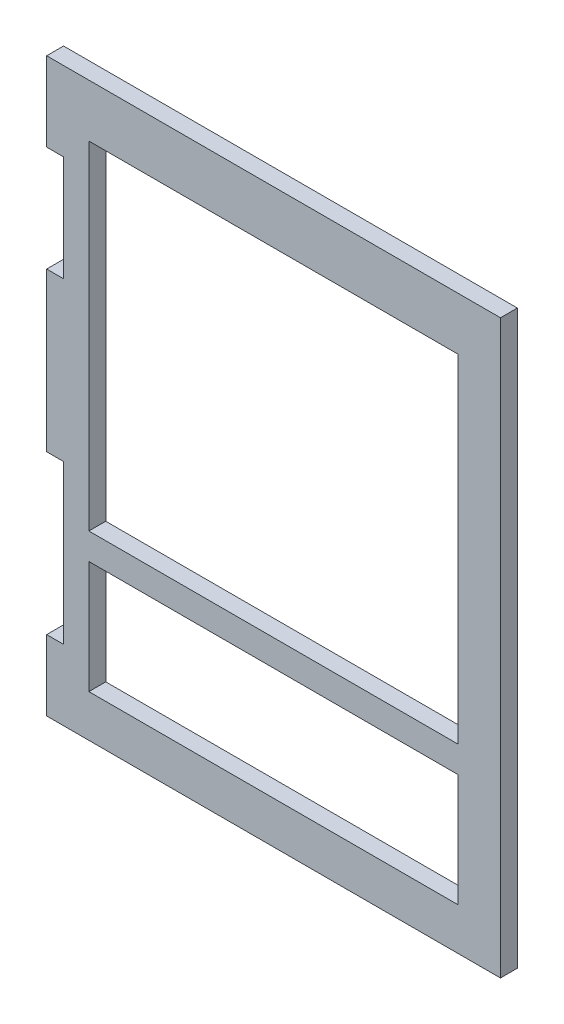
SolidWorks part; units mm, degrees
ref_plane "Front Plane" through (0, 0, 0) normal (0, 0, 1) x (1, 0, 0)
ref_plane "Top Plane" through (0, 0, 0) normal (0, 1, 0) x (1, 0, 0)
ref_plane "Right Plane" through (0, 0, 0) normal (1, 0, 0) x (0, 0, -1)
sketch "Sketch1" plane through (0, 0, 0) normal (0, 0, 1) x (1, 0, 0)
  line L0 (-110.683, 618) -> (-110.683, 543) construction
  line L1 (0, 579.0668) -> (25, 579.0668) construction
  line L2 (0, 76.2) -> (0, 618)
  line L3 (0, 618) -> (430, 618)
  line L4 (430, 76.2) -> (430, 618)
  line L5 (11.9364, 443) -> (11.9364, 293) construction
  line L6 (0, 543) -> (16, 543)
  line L7 (0, 543) -> (0, 443)
  line L8 (0, 443) -> (16, 443)
  line L9 (16, 543) -> (16, 443)
  line L10 (215, 618) -> (215, 76.2) construction
  line L11 (430, 76.2) -> (0, 76.2)
  line L12 (0, 293) -> (16, 293)
  line L13 (0, 293) -> (0, 143)
  line L14 (0, 143) -> (16, 143)
  line L15 (85.4112, 618) -> (85.4112, 568) construction
  line L16 (430, 568) -> (390, 568) construction
  line L17 (90.273, 248) -> (90.273, 223) construction
  line L18 (40, 568) -> (390, 568)
  line L19 (40, 568) -> (40, 248)
  line L20 (40, 248) -> (390, 248)
  line L21 (390, 568) -> (390, 248)
  line L22 (85.4112, 76.2) -> (85.4112, 116.2) construction
  line L23 (16, 293) -> (16, 143)
  line L25 (40, 223) -> (390, 223)
  line L26 (40, 223) -> (40, 116.2)
  line L27 (40, 116.2) -> (390, 116.2)
  line L28 (390, 223) -> (390, 116.2)
extrude "Boss-Extrude1" add sketch "Sketch1" along normal blind 16
equation "\"thk\"= 16mm"
equation "\"D4@Sketch1\"=\"thk\""
equation "\"D1@Boss-Extrude1\"=\"thk\""
equation "\"D7@Sketch1\"=\"thk\""
